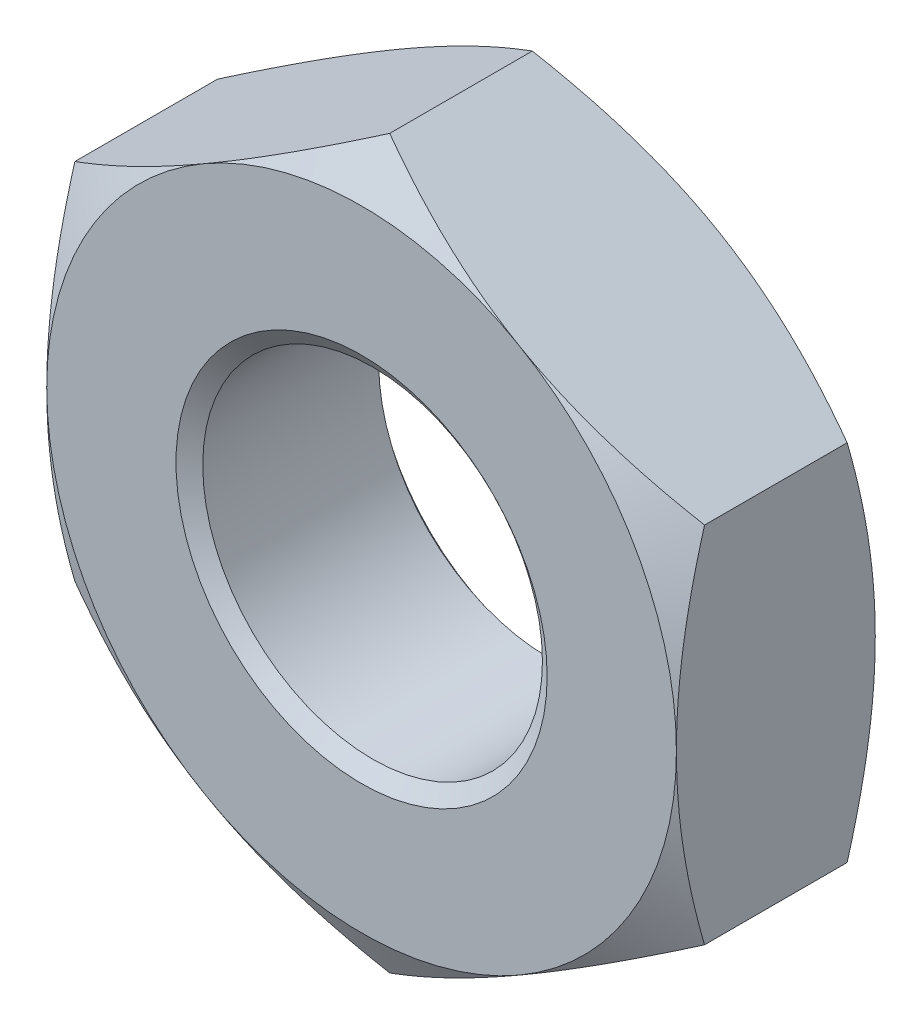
SolidWorks part; units mm, degrees
extrude "BaseNut" add sketch "BaseNutSke" against normal blind 6
sketch "BaseNutSke" plane through (0, 0, 0) normal (0, 0, 1) x (1, 0, 0)
  line L6 (9.5, 5.4848) -> (9.5, -5.4848)
  line L7 (-9.5, 5.4848) -> (-9.5, -5.4848)
  line L8 (9.5, 5.4848) -> (0, 10.9697)
  line L9 (0, 10.9697) -> (-9.5, 5.4848)
  line L10 (-9.5, -5.4848) -> (0, -10.9697)
  line L11 (0, -10.9697) -> (9.5, -5.4848)
  circle A0 centre (0, 0) radius 5.125
pattern_linear "ThdSchPat" [suppressed]
revolve "ThreadSchematic" cut sketch "ThdSchSke" angle 360 about L6
sketch "ThdSchSke" plane through (0, 0, 0) normal (0, 1, 0) x (1, 0, 0)
  line L0 (-5.6, 0.0254) -> (-5.125, 0.358)
  line L1 (-5.125, 0.358) -> (-2.5625, 0.358)
  line L2 (-2.5625, 0.358) -> (-2.5625, -0.3072)
  line L3 (-2.5625, -0.3072) -> (-5.125, -0.3072)
  line L4 (-5.125, -0.3072) -> (-5.6, 0.0254)
  line L5 (-3.175, 1.25) -> (3.175, 1.25) construction
  line L6 (0, 1.25) -> (0, -2.9874) construction
  line L7 (0, 5.642) -> (0, 0.3326) construction
ref_plane "Plane1" through (0, 0, 0) normal (0, 0, 1) x (1, 0, 0)
ref_plane "Plane2" through (0, 0, 0) normal (0, 1, 0) x (1, 0, 0)
ref_plane "Plane3" through (0, 0, 0) normal (1, 0, 0) x (0, 0, -1)
sketch "Sketch3" plane through (0, 0, 0) normal (1, 0, 0) x (0, 0, -1)
  line L0 (6, 9.5) -> (5.1515, 10.9697)
  line L1 (5.1515, 10.9697) -> (5.1515, 20.9697)
  line L2 (5.1515, 20.9697) -> (16, 20.9697)
  line L3 (16, 20.9697) -> (16, 9.5)
  line L4 (16, 9.5) -> (6, 9.5)
  line L5 (6, 5.4848) -> (6, 10.9697) construction
  line L6 (6, 10.9697) -> (0, 10.9697) construction
  line L7 (0, 0) -> (38.6776, 0) construction
  line L8 (6, 0) -> (0, 0) construction
  line L9 (3, 10.9697) -> (3, 44.222) construction
  line L10 (0.8485, 20.9697) -> (-10, 20.9697)
  line L11 (-10, 20.9697) -> (-10, 9.5)
  line L12 (-10, 9.5) -> (0, 9.5)
  line L13 (0, 9.5) -> (0.8485, 10.9697)
  line L14 (0.8485, 10.9697) -> (0.8485, 20.9697)
  line L16 (6, 10.9697) -> (0, 10.9697) construction
revolve "Double-Chamfer" cut sketch "Sketch3" angle 360 about L7
sketch "Sketch5" plane through (0, 0, 0) normal (1, 0, 0) x (0, 0, -1)
  line L0 (5.9746, 5.6) -> (5.5125, 4.94)
  line L1 (6.0254, 5.6) -> (5.9746, 5.6)
  line L2 (6.0254, 5.6) -> (6.0254, 4.94)
  line L3 (6.0254, 4.94) -> (5.5125, 4.94)
  line L6 (-0.0508, 5.6) -> (0, 5.6)
  line L7 (0, 5.6) -> (0.4621, 4.94)
  line L9 (0.4621, 4.94) -> (-0.0508, 4.94)
  line L10 (-0.0508, 4.94) -> (-0.0508, 5.6)
  line L11 (25.0375, 0) -> (38.388, 0) construction
  line L12 (6, 0) -> (0, 0) construction
revolve "EndChamfer" cut sketch "Sketch5" angle 360 about L11
thread "Filetage1" pitch 1.75 start angle 0, offset 5, length 15, pitch 1.75, diameter 10.25
ref_plane "Plan1" through (-5.125, 0, 4.6674) normal (0, -1, 0) x (-1, 0, 0)
sketch "Profil de filetage1" plane through (-5.125, 0, 4.6674) normal (0, -1, 0) x (-1, 0, 0)
  line L0 (0, 0) -> (0, 1.75) construction
  line L1 (0, 0) -> (0.9472, 0.5469)
  line L2 (0.9472, 0.5469) -> (0.9472, 0.7656)
  line L3 (0.9472, 0.7656) -> (0, 1.3125)
  line L4 (0.9472, 0.6562) -> (0, 0.6562) construction
  line L11 (0, 0) -> (0, 1.3125)
  point P2 (0, 0)
  dimension "Pitch" = 1.75
  dimension "Profile_Angle" = 60
  dimension "Profile_Land" = 0.2188
  dimension "Profile_Height" = 0.9472
equation "\"D2@BaseNutSke\" = \"Width_flats@BaseNutSke\" / 2"
equation "\"D3@BaseNutSke\" = \"Width_flats@BaseNutSke\" / 2"
equation "\"D1@Sketch3\" = \"Width_flats@BaseNutSke\" /2"
equation "\"D4@BaseNutSke\" = \"D3@BaseNutSke\""
equation "\"Tap_Drill@ThdSchSke\" = \"Tap_drill@BaseNutSke\""
equation "\"OverCut@ThdSchSke\" = \"Tap_Drill@ThdSchSke\" * 0.5"
equation "\"Num_threads@ThdSchPat\" = int(  ( \"Thickness@BaseNut\" - 0.0508 ) / \"Advance@ThdSchSke\" + 0.999 )  + 1"
equation "\"Advance@ThdSchPat\" = ( \"Thickness@BaseNut\" - 0.0508 ) /  (\"Num_threads@ThdSchPat\" - 1) 'relax it"
equation "' \"Num_threads@ThdSchPat\" = \"Num_threads@ThdSchPat\" - sgn( \"Num_threads@ThdSchPat\" - 1) '---chamfered tips only---"
equation "\"Offset1@Sketch5\" = \"Thickness@BaseNut\" + 0.0254"
equation "\"Offset2@Sketch5\" = \"Offset1@Sketch5\" + 0.0508"
